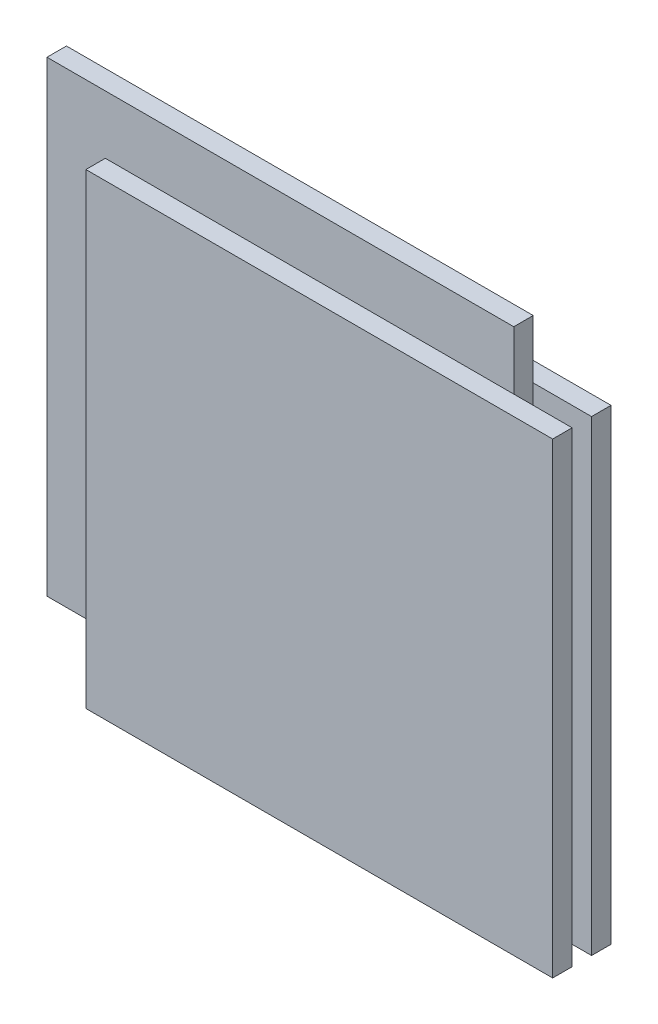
SolidWorks part; units mm, degrees
ref_plane "Front Plane" through (0, 0, 0) normal (0, 0, 1) x (1, 0, 0)
ref_plane "Top Plane" through (0, 0, 0) normal (0, 1, 0) x (1, 0, 0)
ref_plane "Right Plane" through (0, 0, 0) normal (1, 0, 0) x (0, 0, -1)
sketch "Sketch1" plane through (0, 0, 0) normal (0, 0, 1) x (1, 0, 0)
  line L1 (-60, 60) -> (60, 60)
  line L2 (-60, 60) -> (-60, -60)
  line L3 (-60, -60) -> (60, -60)
  line L4 (60, 60) -> (60, -60)
  line L5 (-60, 60) -> (60, -60) construction
  line L6 (-60, -60) -> (60, 60) construction
  point P0 (0, 0)
  dimension "D1" = 120
extrude "Boss-Extrude1" add sketch "Sketch1" along normal mid plane 5
sketch "Sketch2" plane through (0, 0, 2.5) normal (0, 0, 1) x (1, 0, 0)
  line L3 (60, 60) -> (-60, 60) construction
  line L4 (-45, -75) -> (75, -75)
  line L5 (-45, 45) -> (-45, -60)
  line L6 (60, 45) -> (-45, 45)
  line L7 (-45, 45) -> (-45, -75)
  line L8 (75, 45) -> (-45, 45)
  line L9 (75, -75) -> (75, 45)
  dimension "D1" = 15
extrude "Boss-Extrude2" add sketch "Sketch2" along normal blind 5
sketch "Sketch3" plane through (0, 0, -2.5) normal (0, 0, -1) x (-1, 0, 0)
  line L0 (45, -60) -> (45, -75) construction
  line L1 (45, -75) -> (-75, -75) construction
  line L2 (-75, -75) -> (-75, 45) construction
  line L3 (-75, 45) -> (-60, 45) construction
  line L4 (45, 45) -> (45, -75)
  line L5 (45, -75) -> (-75, -75)
  line L6 (-75, -75) -> (-75, 45)
  line L7 (-75, 45) -> (45, 45)
  point P2 (45, 45)
  point P6 (45, 43.6394)
extrude "Boss-Extrude3" add sketch "Sketch3" along normal blind 5
